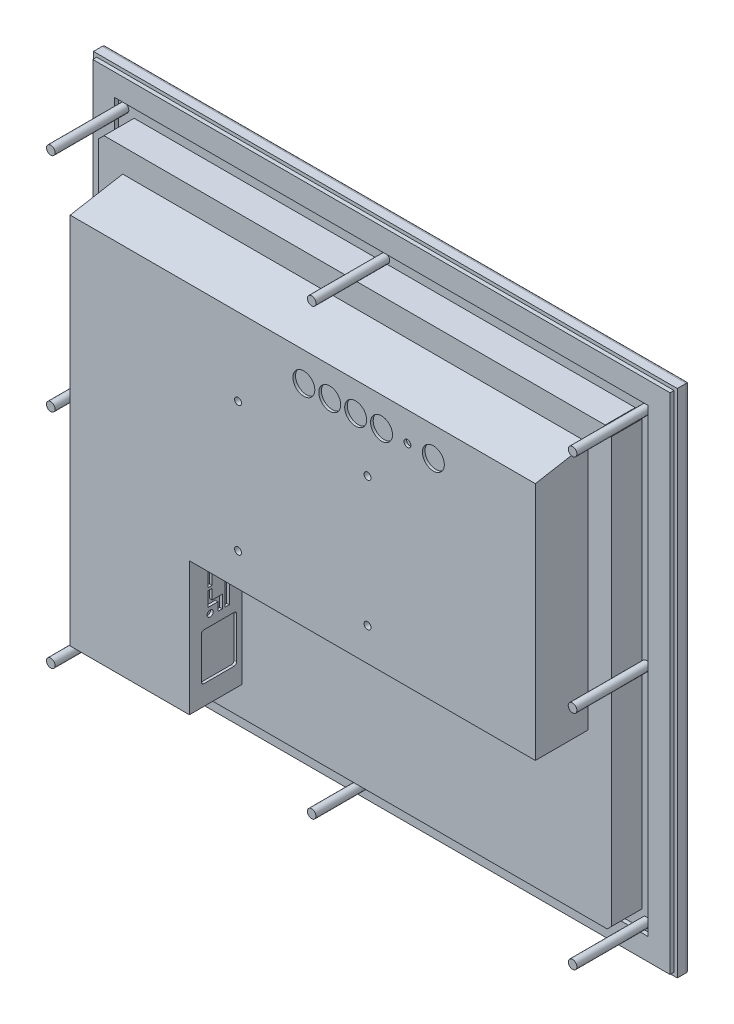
SolidWorks part; units mm, degrees
ref_plane "Front Plane" through (0, 0, 0) normal (0, 0, 1) x (1, 0, 0)
ref_plane "Top Plane" through (0, 0, 0) normal (0, 1, 0) x (1, 0, 0)
ref_plane "Right Plane" through (0, 0, 0) normal (1, 0, 0) x (0, 0, -1)
sketch "Sketch1" plane through (0, 0, 0) normal (0, 0, 1) x (1, 0, 0)
  line L0 (159.1329, 466.8768) -> (497.2577, 466.8768)
  line L1 (497.2577, 466.8768) -> (497.2577, 171.2208)
  line L2 (497.2577, 171.2208) -> (159.1329, 171.2208)
  line L3 (159.1329, 171.2208) -> (159.1329, 466.8768)
extrude "Bezel" add sketch "Sketch1" against normal blind 7.112
fillet "Bezel Radius" radius 2 4 edges at (328.1953, 171.2208, -7.112) (328.1953, 466.8768, -7.112) (159.1329, 319.0488, -7.112) (497.2577, 319.0488, -7.112)
sketch "Sketch2" plane through (0, 0, -7.112) normal (0, 0, -1) x (-1, 0, 0)
  line L0 (-452.8839, 413.7654) -> (-203.5067, 413.7654)
  line L1 (-203.5067, 413.7654) -> (-203.5067, 225.8562)
  line L2 (-203.5067, 225.8562) -> (-452.8839, 225.8562)
  line L3 (-452.8839, 225.8562) -> (-452.8839, 413.7654)
extrude "Window" cut sketch "Sketch2" against normal blind 2.35
sketch "Sketch3" plane through (0, 0, 0) normal (0, 0, 1) x (1, 0, 0)
  line L0 (173.7351, 452.2432) -> (482.6555, 452.2432)
  line L1 (482.6555, 452.2432) -> (482.6555, 185.8548)
  line L2 (482.6555, 185.8548) -> (173.7351, 185.8548)
  line L3 (173.7351, 185.8548) -> (173.7351, 452.2432)
  line L4 (161.0351, 464.9432) -> (495.3555, 464.9432)
  line L5 (495.3555, 464.9432) -> (495.3555, 173.1546)
  line L6 (495.3555, 173.1546) -> (161.0351, 173.1546)
  line L7 (161.0351, 173.1546) -> (161.0351, 464.9432)
extrude "Gasket" add sketch "Sketch3" along normal blind 2.3
sketch "Sketch5" plane through (0, 0, 0) normal (0, 0, 1) x (1, 0, 0)
  circle A0 centre (177.1087, 447.6745) radius 2.5
  circle A1 centre (328.2133, 447.6745) radius 2.5
  circle A2 centre (479.3179, 447.6745) radius 2.5
  circle A3 centre (479.2925, 319.0442) radius 2.5
  circle A4 centre (479.3179, 190.444) radius 2.5
  circle A5 centre (328.2133, 190.444) radius 2.5
  circle A6 centre (177.1087, 190.444) radius 2.5
  circle A7 centre (177.1087, 319.0442) radius 2.5
  dimension "D1" = 5
  dimension "D2" = 5
  dimension "D3" = 5
  dimension "D4" = 5
  dimension "D5" = 5
  dimension "D6" = 5
  dimension "D7" = 5
  dimension "D8" = 5
extrude "Panel Frame Studs" add sketch "Sketch5" along normal blind 42.7
sketch "Sketch6" plane through (0, 0, 0) normal (0, 0, 1) x (1, 0, 0)
  line L0 (179.6487, 442.087) -> (182.6967, 445.135)
  line L1 (182.6967, 445.135) -> (472.914, 445.135)
  line L2 (472.914, 445.135) -> (476.7419, 441.3071)
  line L3 (476.7419, 441.3071) -> (476.7419, 195.6047)
  line L4 (476.7419, 195.6047) -> (474.1212, 192.984)
  line L5 (474.1212, 192.984) -> (182.6758, 192.984)
  line L6 (182.6758, 192.984) -> (179.6487, 196.0111)
  line L7 (179.6487, 196.0111) -> (179.6487, 442.087)
extrude "Body" add sketch "Sketch6" along normal blind 17.4498
sketch "Sketch7" plane through (0, 0, 17.4498) normal (0, 0, 1) x (1, 0, 0)
  line L0 (193.5065, 425.902) -> (462.8989, 425.902)
  line L1 (462.8989, 425.902) -> (462.8989, 287.0656)
  line L2 (462.8989, 287.0656) -> (262.5437, 287.0656)
  line L3 (262.5437, 287.0656) -> (262.5437, 209.7988)
  line L4 (262.5437, 209.7988) -> (193.5065, 209.7988)
  line L5 (193.5065, 209.7988) -> (193.5065, 425.902)
  line L6 (182.6758, 192.984) -> (474.1212, 192.984) construction
  line L7 (476.7419, 195.6047) -> (476.7419, 441.3071) construction
  line L9 (179.6487, 442.087) -> (179.6487, 196.0111) construction
  dimension "D1" = 269.3924
  dimension "D2" = 138.8364
  dimension "D3" = 200.3552
  dimension "D4" = 77.2668
  dimension "D5" = 69.0372
  dimension "D6" = 16.8148
  dimension "D7" = 13.843
extrude "Rear Cover" add sketch "Sketch7" along normal blind 30.4038
draft "Rear Cover Slope" type of draft neutral plane draft angle 10 faces to draft 1 parameters "D1"=10
hole_wizard "Ø4.0mm VESA Holes" positions "Sketch8" profile "Sketch9" hole size "Ø4.0" standard "ANSI Metric"
sketch "Sketch8" plane through (0, 0, 47.8536) normal (0, 0, 1) x (1, 0, 0)
  line L0 (262.5437, 209.7988) -> (262.5437, 287.0656) construction
  line L1 (262.5437, 287.0656) -> (462.8989, 287.0656) construction
  point P0 (290.7123, 381.1156)
  point P2 (365.7123, 381.1156)
  point P4 (365.7123, 306.1156)
  point P6 (290.7123, 306.1156)
  dimension "D1" = 75
  dimension "D2" = 75
  dimension "D3" = 28.1686
  dimension "D4" = 19.05
sketch "Sketch9" plane through (290.7123, 381.1156, 47.8536) normal (1, 0, 0) x (0, -1, 0)
  line L0 (0, 0) -> (0, 17.2037)
  line L1 (0, 17.2037) -> (2, 16.002)
  line L2 (2, 16.002) -> (2, 0)
  line L5 (2, 0) -> (0, 0)
  line L10 (0, 17.2037) -> (-2, 16.002) construction
  line L11 (0, -6.35) -> (0, 107.95) construction
  dimension "Hole Dia." = 4
  dimension "Hole Depth" = 16.002
  dimension "Drill Angle" = 118
sketch "Sketch10" plane through (0, 287.0656, 0) normal (0, 1, 0) x (1, 0, 0)
  line L53 (340.6201, -33.02) -> (340.6201, -27.94)
  line L54 (316.3441, -36.1925) -> (337.5721, -36.1925)
  line L55 (316.3441, -24.7675) -> (337.5721, -24.7675)
  line L56 (313.2961, -27.94) -> (313.2961, -33.02)
  line L57 (374.7884, -29.4513) -> (374.7884, -34.5313)
  line L58 (357.5164, -37.7038) -> (371.7404, -37.7038)
  line L59 (354.4684, -29.4513) -> (354.4684, -34.5313)
  line L60 (357.5164, -26.2788) -> (371.6129, -26.2763)
  line L61 (399.1379, -27.9527) -> (399.1379, -33.0327)
  line L62 (416.4099, -24.7802) -> (402.1859, -24.7802)
  line L63 (419.4579, -33.0327) -> (419.4579, -27.9527)
  line L64 (402.1859, -36.2052) -> (416.2823, -36.2077)
  line L65 (451.0765, -24.384) -> (435.0745, -24.384)
  line L66 (451.0765, -32.0675) -> (451.0765, -36.576)
  line L67 (435.0745, -36.576) -> (451.0765, -36.576)
  line L68 (435.0745, -32.0675) -> (435.0745, -36.576)
  line L69 (430.6295, -32.0675) -> (435.0745, -32.0675)
  line L70 (430.6295, -28.8925) -> (435.0745, -28.8925)
  line L71 (435.0745, -24.384) -> (435.0745, -28.8925)
  line L72 (451.0765, -28.8925) -> (451.0765, -24.384)
  line L73 (451.0765, -32.0675) -> (455.5215, -32.0675)
  line L74 (451.0765, -28.8925) -> (455.5215, -28.8925)
  circle A42 centre (343.2141, -30.48) radius 1.5875
  arc A43 (340.6201, -33.02) -> (337.5721, -36.1925) centre (337.4451, -33.02) cw
  arc A44 (337.5721, -24.7675) -> (340.6201, -27.94) centre (337.4451, -27.94) cw
  arc A45 (313.2961, -27.94) -> (316.3441, -24.7675) centre (316.4711, -27.94) cw
  arc A46 (316.3441, -36.1925) -> (313.2961, -33.02) centre (316.4711, -33.02) cw
  circle A47 centre (310.7021, -30.48) radius 1.5875
  arc A48 (357.5164, -37.7038) -> (354.4684, -34.5313) centre (357.6434, -34.5313) cw
  circle A49 centre (377.1285, -32.004) radius 1.5875
  arc A50 (374.7884, -34.5313) -> (371.7404, -37.7038) centre (371.6134, -34.5313) cw
  circle A51 centre (352.1285, -32.004) radius 1.5875
  arc A52 (354.4684, -29.4513) -> (357.5164, -26.2788) centre (357.6434, -29.4513) cw
  arc A53 (371.6129, -26.2763) -> (374.7884, -29.4513) centre (371.6134, -29.4513) cw
  circle A54 centre (396.7979, -30.48) radius 1.5875
  arc A55 (399.1379, -27.9527) -> (402.1859, -24.7802) centre (402.3129, -27.9527) cw
  arc A56 (416.4099, -24.7802) -> (419.4579, -27.9527) centre (416.2829, -27.9527) cw
  arc A57 (419.4579, -33.0327) -> (416.2823, -36.2077) centre (416.2829, -33.0327) cw
  arc A58 (402.1859, -36.2052) -> (399.1379, -33.0327) centre (402.3129, -33.0327) cw
  circle A59 centre (421.7979, -30.48) radius 1.5875
  arc A60 (430.6295, -32.0675) -> (430.6295, -28.8925) centre (430.6295, -30.48) cw
  arc A61 (455.5215, -28.8925) -> (455.5215, -32.0675) centre (455.5215, -30.48) cw
extrude "Video / Touch" cut sketch "Sketch10" along normal blind 1.524
sketch "Sketch11" plane through (262.5437, 0, 0) normal (-1, 0, 0) x (0, 0, 1)
  line L49 (31.3182, 253.4233) -> (31.3182, 258.2366)
  line L50 (31.3182, 253.4233) -> (28.7782, 253.4233)
  line L51 (28.7782, 253.4233) -> (28.7782, 260.7766)
  line L52 (27.2542, 281.3633) -> (27.2542, 253.4233)
  line L53 (27.2542, 253.4233) -> (24.7142, 253.4233)
  line L54 (24.7142, 253.4233) -> (24.7142, 281.3633)
  line L55 (24.7142, 281.3633) -> (27.2542, 281.3633)
  line L56 (28.7782, 281.3633) -> (31.3182, 281.3633)
  line L57 (31.3182, 281.3633) -> (31.3182, 276.55)
  line L58 (28.7782, 281.3633) -> (28.7782, 274.01)
  line L59 (28.7782, 274.01) -> (34.671, 274.01)
  line L60 (31.3182, 276.55) -> (37.211, 276.55)
  line L61 (37.211, 276.55) -> (37.211, 268.1553)
  line L62 (37.211, 268.1553) -> (34.671, 268.1553)
  line L63 (34.671, 274.01) -> (34.671, 268.1553)
  line L64 (34.671, 266.6313) -> (37.211, 266.6313)
  line L65 (37.211, 258.2366) -> (37.211, 266.6313)
  line L66 (34.671, 266.6313) -> (34.671, 260.7766)
  line L67 (28.7782, 260.7766) -> (34.671, 260.7766)
  line L68 (31.3182, 258.2366) -> (37.211, 258.2366)
  line L69 (20.4599, 246.6911) -> (20.4599, 222.7516)
  line L70 (21.9839, 248.2151) -> (39.4353, 248.2151)
  line L71 (40.9578, 222.7516) -> (40.9578, 246.6911)
  line L72 (39.4338, 221.2276) -> (21.9824, 221.2276)
  circle A12 centre (35.814, 254.6044) radius 1.7907
  circle A13 centre (35.814, 280.1822) radius 1.7907
  arc A14 (21.9824, 221.2276) -> (20.4599, 222.7516) centre (21.9839, 222.7516) cw
  arc A15 (20.4599, 246.6911) -> (21.9839, 248.2151) centre (21.9839, 246.6911) cw
  arc A16 (39.4353, 248.2151) -> (40.9578, 246.6911) centre (39.4338, 246.6911) cw
  arc A17 (40.9578, 222.7516) -> (39.4338, 221.2276) centre (39.4338, 222.7516) cw
extrude "Power AC and DC" cut sketch "Sketch11" along normal blind 1.524
sketch "Sketch12" plane through (0, 0, 47.8536) normal (0, 0, 1) x (1, 0, 0)
  circle A6 centre (328.8315, 409.0302) radius 6.35
  circle A7 centre (343.8315, 409.0302) radius 6.35
  circle A8 centre (358.8315, 409.0302) radius 6.35
  circle A9 centre (373.8315, 409.0302) radius 6.35
  circle A10 centre (388.8315, 409.0302) radius 1.9812
  circle A11 centre (403.8315, 409.0302) radius 6.35
extrude "Controls Buttons" cut sketch "Sketch12" against normal blind 1.524
